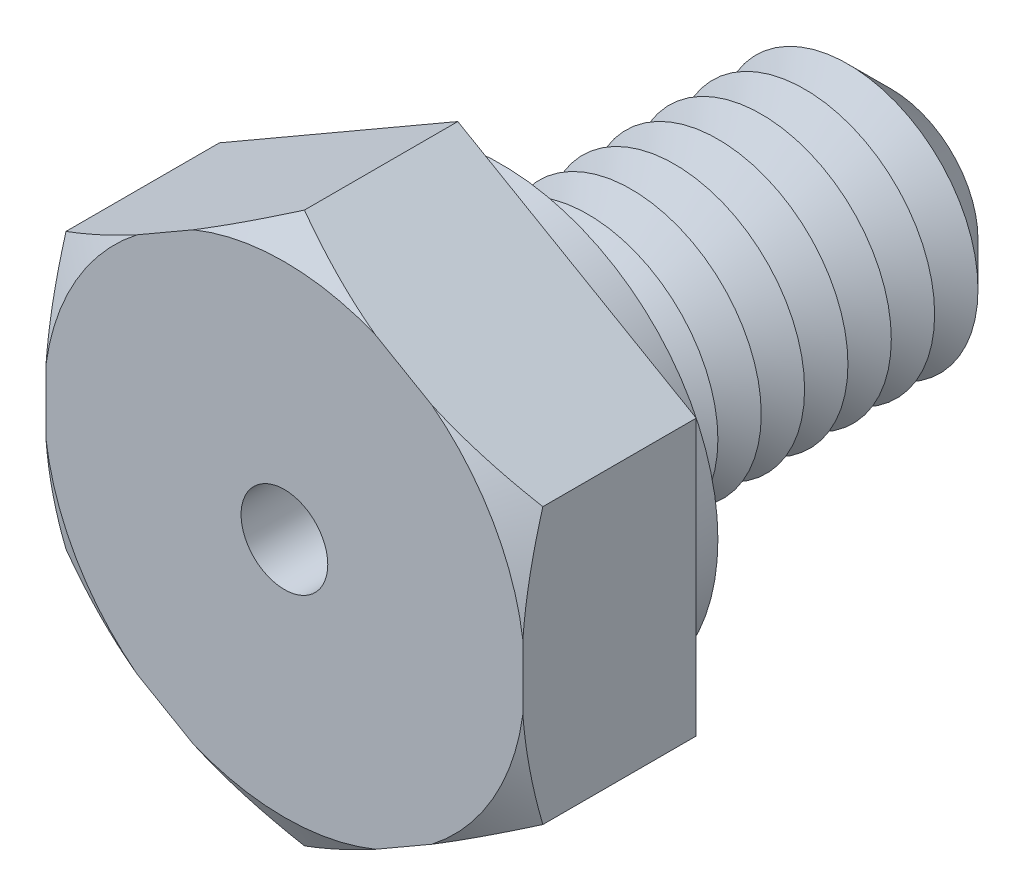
SolidWorks part; units mm, degrees
ref_plane "Front Plane" through (0, 0, 0) normal (0, 0, 1) x (1, 0, 0)
ref_plane "Top Plane" through (0, 0, 0) normal (0, 1, 0) x (1, 0, 0)
ref_plane "Right Plane" through (0, 0, 0) normal (1, 0, 0) x (0, 0, -1)
sketch "Sketch2" plane through (0, 0, 0) normal (0, 0, 1) x (1, 0, 0)
  line L1 (0, 3.1754) -> (-2.75, 1.5877)
  line L2 (-2.75, 1.5877) -> (-2.75, -1.5877)
  line L3 (-2.75, -1.5877) -> (0, -3.1754)
  line L4 (0, -3.1754) -> (2.75, -1.5877)
  line L5 (2.75, -1.5877) -> (2.75, 1.5877)
  line L6 (2.75, 1.5877) -> (0, 3.1754)
  circle A0 centre (0, 0) radius 2.75 construction
  dimension "D1" = 5.5
extrude "Boss-Extrude1" add sketch "Sketch2" along normal blind 2
sketch "Sketch3" plane through (0, 0, 0) normal (0, 0, -1) x (-1, 0, 0)
  circle A0 centre (0, 0) radius 1.5
  dimension "D1" = 3
extrude "Boss-Extrude2" add sketch "Sketch3" along normal blind 5
sketch "Sketch4" plane through (0, 0, 0) normal (0, 0, -1) x (-1, 0, 0)
  circle A0 centre (0, 0) radius 2.5
  dimension "D1" = 5
extrude "Boss-Extrude3" add sketch "Sketch4" along normal blind 0.5
sketch "Sketch5" plane through (0, 0, 0) normal (1, 0, 0) x (0, 0, -1)
  line L0 (-3.2117, 0) -> (6.3192, 0) construction
chamfer "Chamfer1" distance 0.5 angle 45 1 edges at (-1.5, 0, -5)
sketch "Sketch6" plane through (0, 0, 0) normal (1, 0, 0) x (0, 0, -1)
  line L0 (0.5, 1.5) -> (0.75, 1.067)
  line L1 (0.75, 1.067) -> (1, 1.5)
  line L2 (4.5, 1.5) -> (0.5, 1.5) construction
  line L3 (1, 1.5) -> (0.5, 1.5)
  dimension "D1" = 0.5
revolve "Cut-Revolve1" cut sketch "Sketch6" angle 360 about L0
pattern_linear "LPattern1" count 8 spacing 0.5 along (0, 0, -1) of "Cut-Revolve1"
sketch "Sketch7" plane through (0, 0, 0) normal (1, 0, 0) x (0, 0, -1)
  line L0 (-2, 3.1754) -> (-2, 2.7754)
  line L1 (-2, 1.5877) -> (-2, 3.1754) construction
  line L2 (-2, 2.7754) -> (-1.7691, 3.1754)
  line L3 (-2, 3.1754) -> (0, 3.1754) construction
  line L4 (-1.7691, 3.1754) -> (-2, 3.1754)
  dimension "D1" = 0.4
  dimension "D2" = 30
revolve "Cut-Revolve2" cut sketch "Sketch7" angle 360 about L0
sketch "Sketch8" plane through (0, 0, 2) normal (0, 0, 1) x (1, 0, 0)
  circle A0 centre (0, 0) radius 0.5
  dimension "D1" = 1
extrude "Cut-Extrude1" cut sketch "Sketch8" against normal up to surface (7 mm away)
